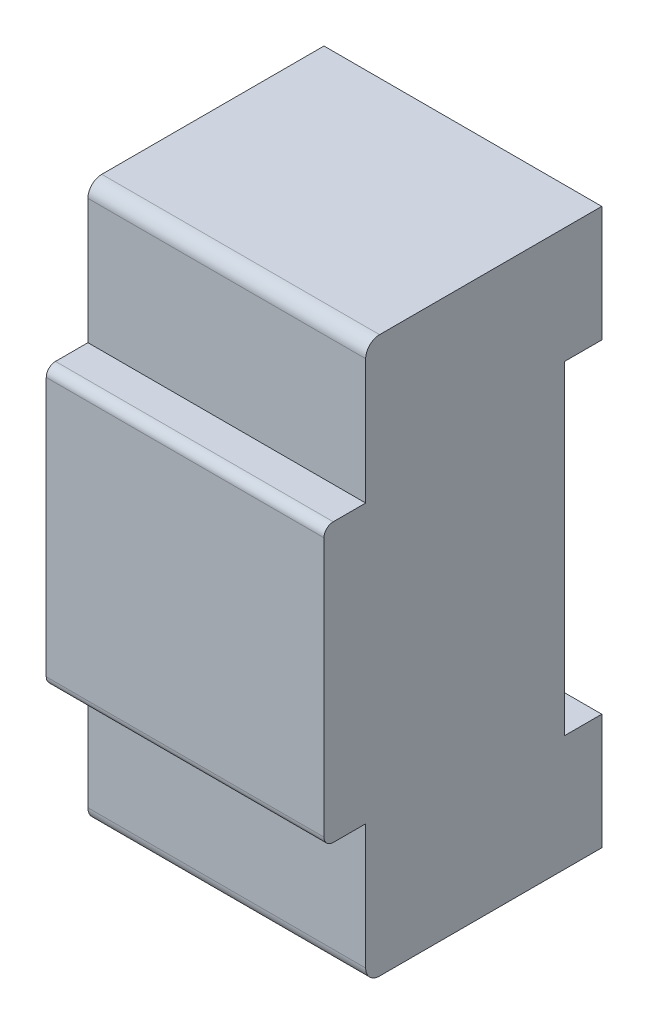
SolidWorks part; units mm, degrees
ref_plane "Plan de face" through (0, 0, 0) normal (0, 0, 1) x (1, 0, 0)
ref_plane "Plan de dessus" through (0, 0, 0) normal (0, 1, 0) x (1, 0, 0)
ref_plane "Plan de droite" through (0, 0, 0) normal (1, 0, 0) x (0, 0, -1)
sketch "EW_SKETCH" plane through (0, 0, 0) normal (1, 0, 0) x (0, 0, -1)
  line L0 (0, 0) -> (4, 0)
  line L1 (4, 0) -> (4, 12.5)
  line L2 (4, 12.5) -> (-21.5, 12.5)
  line L3 (-21.5, 12.5) -> (-21.5, -2.5)
  line L4 (-21.5, -2.5) -> (-26, -2.5)
  line L5 (-26, -2.5) -> (-26, -32.5)
  line L6 (-26, -32.5) -> (-21.5, -32.5)
  line L7 (-21.5, -32.5) -> (-21.5, -47.5)
  line L8 (-21.5, -47.5) -> (4, -47.5)
  line L9 (4, -47.5) -> (4, -35)
  line L10 (4, -35) -> (0, -35)
  line L11 (0, -35) -> (0, 0)
  dimension "h_rail" = 35
  dimension "d_rail" = 4
  dimension "EW_HEIGHT" = 60
  dimension "EW_DEPTH" = 30
  dimension "offset" = 4.5
  dimension "hoffset" = 30
extrude "EW_EXTRUDE" add sketch "EW_SKETCH" along normal blind 30
fillet "fillet1" radius 1.5 2 edges at (15, -47.5, 21.5) (15, 12.5, 21.5)
fillet "fillet2" radius 1 2 edges at (15, -32.5, 26) (15, -2.5, 26)
equation "\"offset@EW_SKETCH\"=\"EW_DEPTH@EW_SKETCH\"*0.15"
equation "\"hoffset@EW_SKETCH\"=\"EW_HEIGHT@EW_SKETCH\"*0.5"
equation "\"d_rail@EW_SKETCH\"=4"
equation "\"h_rail@EW_SKETCH\"=35"
equation "\"rfillet1@fillet1\"=\"EW_HEIGHT@EW_SKETCH\"/40"
equation "\"rfillet2@fillet2\"=\"EW_HEIGHT@EW_SKETCH\"/60"
